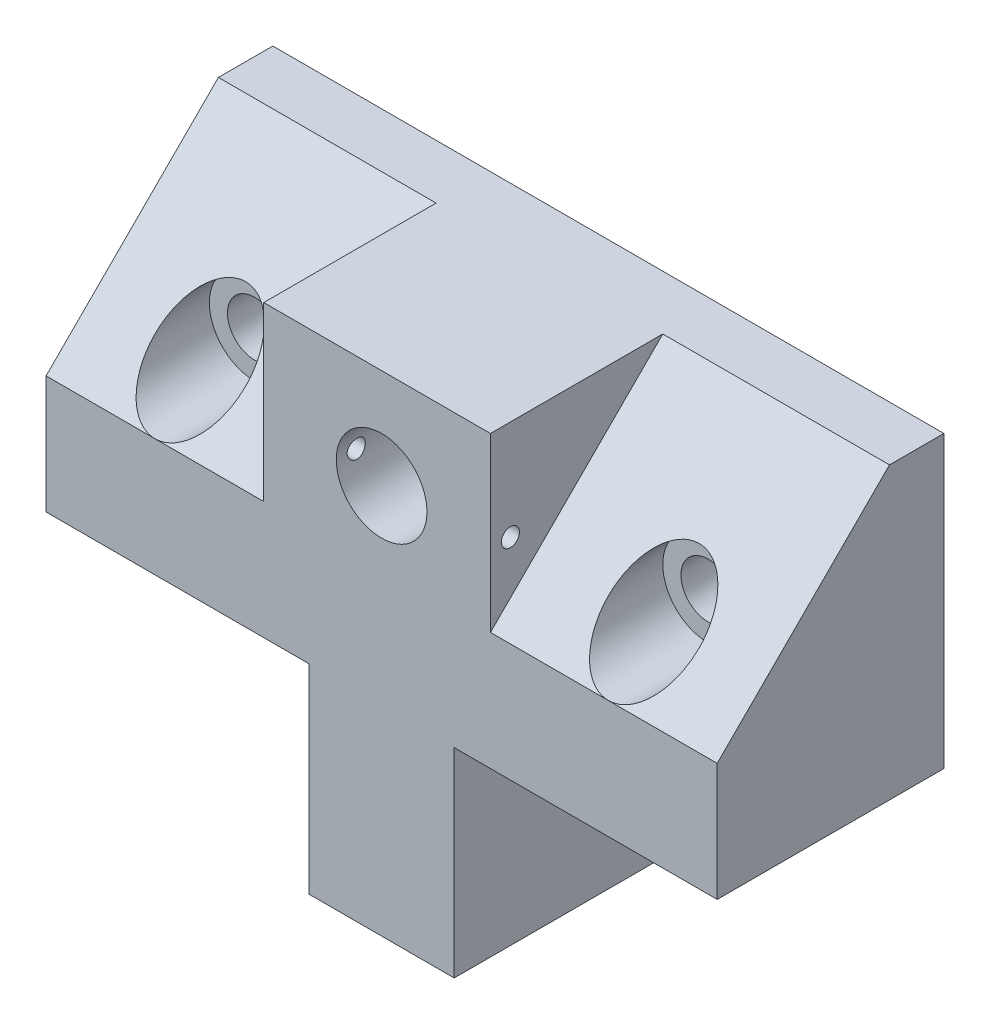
SolidWorks part; units mm, degrees
ref_plane "Front Plane" through (0, 0, 0) normal (0, 0, 1) x (1, 0, 0)
ref_plane "Top Plane" through (0, 0, 0) normal (0, 1, 0) x (1, 0, 0)
ref_plane "Right Plane" through (0, 0, 0) normal (1, 0, 0) x (0, 0, -1)
sketch "Sketch1" plane through (0, 0, 0) normal (0, 1, 0) x (1, 0, 0)
  line L0 (0, -12.5) -> (0, -7.3684) construction
  line L1 (-37, -12.5) -> (37, -12.5)
  line L2 (-37, -12.5) -> (-37, 12.5)
  line L3 (-37, 12.5) -> (37, 12.5)
  line L4 (37, -12.5) -> (37, 12.5)
  line L5 (-37, -12.5) -> (37, 12.5) construction
  line L6 (-37, 12.5) -> (37, -12.5) construction
  point P0 (0, 0)
  point P6 (-12, -12.5)
  point P9 (12, -12.5)
  dimension "D1" = 74
  dimension "D2" = 25
  dimension "D3" = 25
extrude "Boss-Extrude1" add sketch "Sketch1" along normal blind 54
sketch "Sketch2" plane through (0, 0, 12.5) normal (0, 0, 1) x (1, 0, 0)
  line L0 (-37, 22) -> (-8, 22)
  line L1 (-37, 54) -> (-37, 0) construction
  line L2 (-8, 22) -> (-8, 0)
  line L3 (-37, 0) -> (37, 0) construction
  line L4 (8, 22) -> (8, 0)
  line L5 (0, 0) -> (0, 15.4491) construction
  line L6 (37, 22) -> (8, 22)
  line L7 (-37, 22) -> (-37, 0)
  line L8 (-37, 0) -> (-8, 0)
  line L9 (8, 0) -> (37, 0)
  line L10 (37, 22) -> (37, 0)
  dimension "D1" = 8
  dimension "D2" = 22
extrude "Cut-Extrude1" cut sketch "Sketch2" against normal up to surface (25 mm away)
fillet "Chamfer1" radius 19
fillet "Chamfer3" radius 19 1 edges at (-12.5, 54, 12.5)
sketch "Sketch4" plane through (0, 0, 12.5) normal (0, 0, 1) x (1, 0, 0)
  line L0 (-13, 54) -> (12, 54) construction
  circle A0 centre (0, 43) radius 5
  dimension "D1" = 10
  dimension "D2" = 11
extrude "Cut-Extrude2" cut sketch "Sketch4" against normal blind 13
sketch "Sketch5" plane through (12, 0, 0) normal (1, 0, 0) x (0, 0, -1)
  line L0 (0.5, 43) -> (-16.3509, 43) construction
  line L1 (0.5, 48) -> (0.5, 38) construction
  circle A0 centre (-10.3055, 43) radius 1
extrude "Cut-Extrude3" cut sketch "Sketch5" against normal up to surface (25 mm away)
sketch "Sketch6" plane through (0, 0, -12.5) normal (0, 0, -1) x (-1, 0, 0)
  line L0 (-37, 54) -> (-37, 22) construction
  line L1 (-37, 54) -> (37, 54) construction
  point P0 (-25, 40)
  dimension "D1" = 12
  dimension "D2" = 14
sketch "Sketch7" plane through (0, 0, 12.5) normal (0, 0, 1) x (1, 0, 0)
  line L0 (-37, 35) -> (-37, 54) construction
  line L1 (-13, 54) -> (12, 54) construction
  point P0 (-25, 40)
  dimension "D1" = 12
  dimension "D2" = 14
hole_wizard "CBORE for M5 Cheese Head Screw1" positions "Sketch7" profile "Sketch8" counterbore size "M5" standard "ISO"
sketch "Sketch8" plane through (-25, 40, 12.5) normal (1, 0, 0) x (0, -1, 0)
  line L0 (0, 0) -> (0, 26.8026)
  line L1 (0, 26.8026) -> (3, 25)
  line L2 (3, 25) -> (3, 11)
  line L3 (3, 11) -> (5, 11)
  line L4 (5, 11) -> (5, 0)
  line L5 (5, 0) -> (0, 0)
  line L10 (0, 26.8026) -> (-3, 25) construction
  line L11 (0, -6.35) -> (0, 107.95) construction
  dimension "Hole Dia." = 6
  dimension "Hole Depth" = 25
  dimension "C'Bore Dia." = 10
  dimension "C'Bore Depth" = 11
  dimension "Drill Angle" = 118
mirror "Mirror1" about plane through (0, 0, 0) normal (1, 0, 0) of "CBORE for M5 Cheese Head Screw1"
